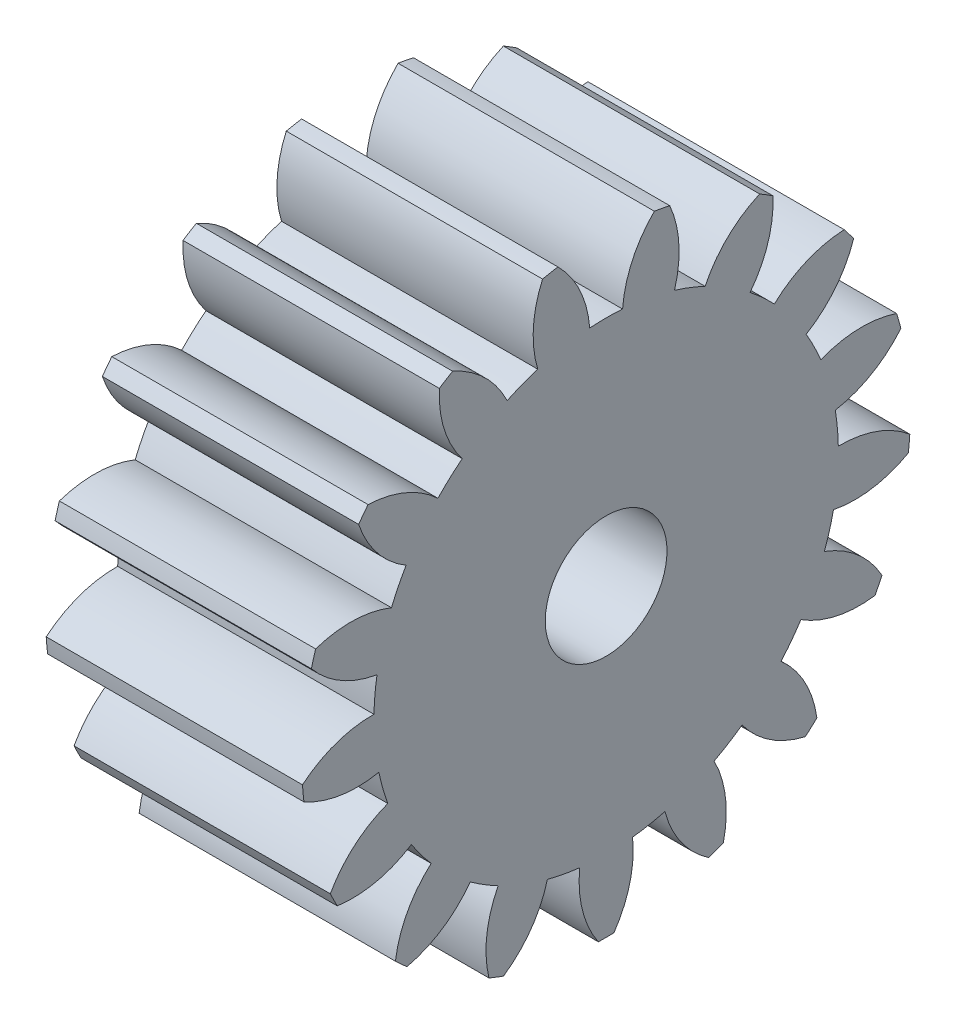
SolidWorks part; units mm, degrees
ref_plane "Plane1" through (0, 0, 0) normal (0, 0, 1) x (1, 0, 0)
ref_plane "Plane2" through (0, 0, 0) normal (0, 1, 0) x (1, 0, 0)
ref_plane "Plane3" through (0, 0, 0) normal (1, 0, 0) x (0, 0, -1)
other "Configuration Table"
sketch "HoldingSke" plane through (0, 0, 0) normal (0, 1, 0) x (1, 0, 0)
  line L0 (0, 0) -> (0.6375, -0.1949)
  line L1 (-15, 0) -> (100, 0) construction
  line L2 (0, 0) -> (-2.1039, 2.3779)
  line L3 (0, 0) -> (-11.863, 4.5341)
  line L4 (0, 0) -> (8.2586, 2.5249)
  line L5 (0, 0) -> (-46.8476, -17.4728)
  line L6 (0, 0) -> (-9.9476, -6.7116)
  line L7 (-2.1039, 2.3779) -> (8.6586, 51.2059)
  line L8 (-76.2, 54.61) -> (-75.3, 54.61)
  line L9 (-71.009, 38.7566) -> (-53.1078, 45.2721)
  line L10 (-76.2, 71.12) -> (104.1128, 71.12)
  line L11 (0, 0) -> (-12, 0)
  line L12 (-76.2, 101.6) -> (-76.147, 101.6)
  line L13 (24.9733, 27.94) -> (52.9518, 28.4284)
  line L14 (24.9733, 27.94) -> (24.9743, 27.94)
  line L15 (24.9733, 27.94) -> (100.4006, 29.5858)
  line L16 (-63.627, -1.5) -> (-12.827, -1.5)
  circle A0 centre (0, 0) radius 2.5
  circle A1 centre (0, 0) radius 10.874
  circle A2 centre (0, 0) radius 37.5
  circle A3 centre (0, 0) radius 2.5
sketch "BasProSke" plane through (0, 0, 0) normal (0, 1, 0) x (1, 0, 0)
  line L0 (-10, 0) -> (60, 0) construction
  line L1 (0, 0) -> (0, 14.25)
  line L2 (0, 0) -> (12, 0)
  line L3 (12, 0) -> (12, 14.25)
  line L4 (12, 14.25) -> (0, 14.25)
revolve "Base-Revolve" add sketch "BasProSke" angle 360 about L0
sketch "TooCutSke" plane through (0, 0, 0) normal (1, 0, 0) x (0, 0, -1)
  line L1 (0, 0) -> (0, 107) construction
  line L2 (0, 0) -> (-1.2691, 12.6867) construction
  line L3 (0, 0) -> (-4.6687, 24.9751) construction
  line L4 (-1.2691, 12.6867) -> (-2.3343, 12.4876) construction
  arc A0 (0.7694, 10.8467) -> (-0.7694, 10.8467) centre (0, 0) ccw
  arc A1 (2.2806, 14.0921) -> (-2.2806, 14.0921) centre (0, 0) ccw
  circle A2 centre (0, 0) radius 12.75 construction
  circle A3 centre (0, 0) radius 11.9811 construction
  arc A4 (-0.7694, 10.8467) -> (-2.2806, 14.0921) centre (-5.8542, 10.4535) ccw
  arc A5 (2.2806, 14.0921) -> (0.7694, 10.8467) centre (5.8542, 10.4535) ccw
extrude "ToothCut" cut sketch "TooCutSke" along normal through all
fillet "Breaks" [suppressed] radius 0.03
fillet "RootFillets" [suppressed] radius 0.376
pattern_circular "TeethCuts" count 17 every 21.176 about axis through (-10, 0, 0) along (1, 0, 0) of "ToothCut", "RootFillets", "Breaks"
sketch "HubNeaOneSke" plane through (0, 0, 0) normal (-1, 0, 0) x (0, 0, 1)
  circle A0 centre (0, 0) radius 10.874
extrude "HubNearOne" [suppressed] add sketch "HubNeaOneSke" along normal blind 38.0001
sketch "HubNeaBotSke" plane through (0, 0, 0) normal (-1, 0, 0) x (0, 0, 1)
  circle A0 centre (0, 0) radius 10.874
extrude "HubNearBoth" [suppressed] add sketch "HubNeaBotSke" along normal blind 19
ref_plane "FarPln" through (12, 0, 0) normal (1, 0, 0) x (0, 0, -1)
sketch "HubFarSke" plane through (12, 0, 0) normal (1, 0, 0) x (0, 0, -1)
  circle A0 centre (0, 0) radius 10.874
extrude "HubFar" [suppressed] add sketch "HubFarSke" along normal blind 19
sketch "BorSke" plane through (0, 0, 0) normal (1, 0, 0) x (0, 0, -1)
  circle A0 centre (0, 0) radius 2.85
extrude "Bore" cut sketch "BorSke" along normal mid plane 100.0001
sketch "KeySke" plane through (0, 0, 0) normal (1, 0, 0) x (0, 0, -1)
  line L0 (-1, 0) -> (-1, 3.4)
  line L1 (-1, 3.4) -> (1, 3.4)
  line L2 (1, 3.4) -> (1, 0)
  line L3 (0, 0) -> (0, 34) construction
  line L4 (-1, 0) -> (1, 0)
extrude "Keyway" [suppressed] cut sketch "KeySke" along normal mid plane 100.0001
pattern_circular "Keyway2" [suppressed] count 2 every 90 about axis through (-10, 0, 0) along (1, 0, 0)
sketch "Sketch1" plane through (0, 0, 0) normal (-1, 0, 0) x (0, 0, 1)
  point P0 (0, 0)
equation "' \"Module@HoldingSke\" = 6.35"
equation "' \"Num_teeth@HoldingSke\" = 12"
equation "' \"Ap@HoldingSke\" =  20"
equation "' \"Ap@HoldingSke\" = 20"
equation "' \"Width@HoldingSke\" = 0.5 * 25.4"
equation "' \"Hub_dia@HoldingSke\"= 1 * 25.4"
equation "' \"Hub_dia@HoldingSke\" = 1 * 25.4"
equation "' \"Overall_len@HoldingSke\" = 1.0 * 25.4"
equation "' \"Bore@HoldingSke\" = 0.75 * 25.4"
equation "' \"T_dim@HoldingSke\" = 0.1 * 25.4"
equation "' \"Width@KeySke\" = 0.25 * 25.4"
equation "' \"Show_teeth@HoldingSke\" = 13"
equation "' \"Backlash@HoldingSke\" = 0.009 * 25.4"
equation "' \"Addendum_fac@HoldingSke\" = 1.0"
equation "' \"Dedendum_fac@HoldingSke\" = 1.25"
equation "' \"Dedendum_add@HoldingSke\" = 0.00005 * 25.4"
equation "' \"Clearance_fac@HoldingSke\" = 0.25"
equation "\"Pitch@HoldingSke\" = 1 / \"Module@HoldingSke\""
equation "\"Overcut_dia@TooCutSke\" = (\"Num_teeth@HoldingSke\" + 2 * \"Addendum_fac@HoldingSke\") / \"Pitch@HoldingSke\" + 0.002 * 25.4"
equation "\"Pitch_dia@TooCutSke\" = \"Num_teeth@HoldingSke\" / \"Pitch@HoldingSke\""
equation "\"Base_dia@TooCutSke\" = \"Num_teeth@HoldingSke\" / \"Pitch@HoldingSke\" * cos((\"Ap@HoldingSke\"  * 3.14159265 / 180))"
equation "\"Root_dia@TooCutSke\" = (\"Num_teeth@HoldingSke\" + 2) / \"Pitch@HoldingSke\" - 2 * (\"Addendum_fac@HoldingSke\" + \"Dedendum_fac@HoldingSke\") / \"Pitch@HoldingSke\" - \"Dedendum_add@HoldingSke\" * 2"
equation "\"Half_ang@TooCutSke\" = 180 / \"Num_teeth@HoldingSke\""
equation "\"Half_CT@TooCutSke\" = \"Num_teeth@HoldingSke\" / \"Pitch@HoldingSke\" * sin((3.14159265 / 2 / \"Num_teeth@HoldingSke\")) / 2 - 7 * \"Backlash@HoldingSke\" / 4"
equation "\"Flank_rad@TooCutSke\" = \"Num_teeth@HoldingSke\" / \"Pitch@HoldingSke\" / 5"
equation "\"Radius@RootFillets\" = \"Clearance_fac@HoldingSke\" / \"Pitch@HoldingSke\" + \"Dedendum_add@HoldingSke\""
equation "\"Break_rad@Breaks\" = 0.02 / \"Pitch@HoldingSke\""
equation "\"Thickness@HoldingSke\" = \"Width@HoldingSke\""
equation "\"OAL@HoldingSke\" = \"Thickness@HoldingSke\""
equation "\"MHD@HoldingSke\" = (\"Num_teeth@HoldingSke\" + 2) / \"Pitch@HoldingSke\" - 2 * (\"Addendum_fac@HoldingSke\" + \"Dedendum_fac@HoldingSke\")  / \"Pitch@HoldingSke\" - \"Dedendum_add@HoldingSke\" * 2"
equation "\"MBD@HoldingSke\" = (\"Num_teeth@HoldingSke\" + 2) / \"Pitch@HoldingSke\" - 2 * (\"Addendum_fac@HoldingSke\" + \"Dedendum_fac@HoldingSke\")  / \"Pitch@HoldingSke\" - \"Dedendum_add@HoldingSke\" * 2 - 0.002 * 25.4"
equation "\"MHD@HoldingSke\" = ((sgn( \"MHD@HoldingSke\" - \"Hub_dia@HoldingSke\" )-1)*( \"MHD@HoldingSke\" - \"Hub_dia@HoldingSke\" ))/-2+ \"Hub_dia@HoldingSke\""
equation "\"MBD@HoldingSke\" = ((sgn( \"MBD@HoldingSke\" - \"Bore@HoldingSke\" )-1)*( \"MBD@HoldingSke\" - \"Bore@HoldingSke\" ))/-2+ \"Bore@HoldingSke\""
equation "\"OAL@HoldingSke\" = ((sgn( \"OAL@HoldingSke\" - \"Overall_len@HoldingSke\" )+1)*( \"OAL@HoldingSke\" - \"Overall_len@HoldingSke\" ))/2 + \"Overall_len@HoldingSke\" + 0.000002 * 25.4"
equation "\"Num_teeth@TeethCuts\" = int( \"Show_teeth@HoldingSke\" ) + 1"
equation "\"Num_teeth@TeethCuts\" = ((sgn( \"Num_teeth@TeethCuts\" - \"Num_teeth@HoldingSke\" )-1)*( \"Num_teeth@TeethCuts\" - \"Num_teeth@HoldingSke\" ))/-2+ \"Num_teeth@HoldingSke\""
equation "\"Num_teeth@TeethCuts\" = ((sgn( \"Num_teeth@TeethCuts\" - 2.0)+1)*( \"Num_teeth@TeethCuts\" - 2.0))/2 +2.0"
equation "\"Angle@TeethCuts\" = 360.0 / \"Num_teeth@HoldingSke\""
equation "\"Diameter@BasProSke\" = (\"Num_teeth@HoldingSke\" + 2 * \"Addendum_fac@HoldingSke\") / \"Pitch@HoldingSke\""
equation "\"Thickness@BasProSke\"  = \"Thickness@HoldingSke\""
equation "' \"Fillet_rad@BasProSke\" =  \"Thickness@HoldingSke\" * 0.05"
equation "' \"Fillet_rad@BasProSke\" = \"Thickness@HoldingSke\" * 0.05"
equation "\"MHD@HoldingSke\" = ((sgn( \"MHD@HoldingSke\" - \"Root_dia@TooCutSke\" )-1)*( \"MHD@HoldingSke\" - \"Root_dia@TooCutSke\" ))/-2+ \"Root_dia@TooCutSke\""
equation "\"Diameter@HubNeaOneSke\" = \"MHD@HoldingSke\""
equation "\"Length@HubNearOne\" = \"OAL@HoldingSke\" - \"Thickness@BasProSke\""
equation "\"Diameter@HubNeaBotSke\" = \"MHD@HoldingSke\""
equation "\"Length@HubNearBoth\" = ( \"OAL@HoldingSke\" - \"Thickness@BasProSke\" ) / 2.0"
equation "\"Thickness@FarPln\" = \"Thickness@BasProSke\""
equation "\"Diameter@HubFarSke\" = \"MHD@HoldingSke\""
equation "\"Length@HubFar\" = ( \"OAL@HoldingSke\" - \"Thickness@BasProSke\" ) / 2.0"
equation "\"Diameter@BorSke\"=5.7"
equation "\"D1@Bore\" = \"OAL@HoldingSke\" * 2.0"
equation "\"D1@Keyway\" = \"OAL@HoldingSke\" * 2.0"
equation "\"Offset@KeySke\" = \"T_dim@HoldingSke\" + \"MBD@HoldingSke\" / 2.0"
